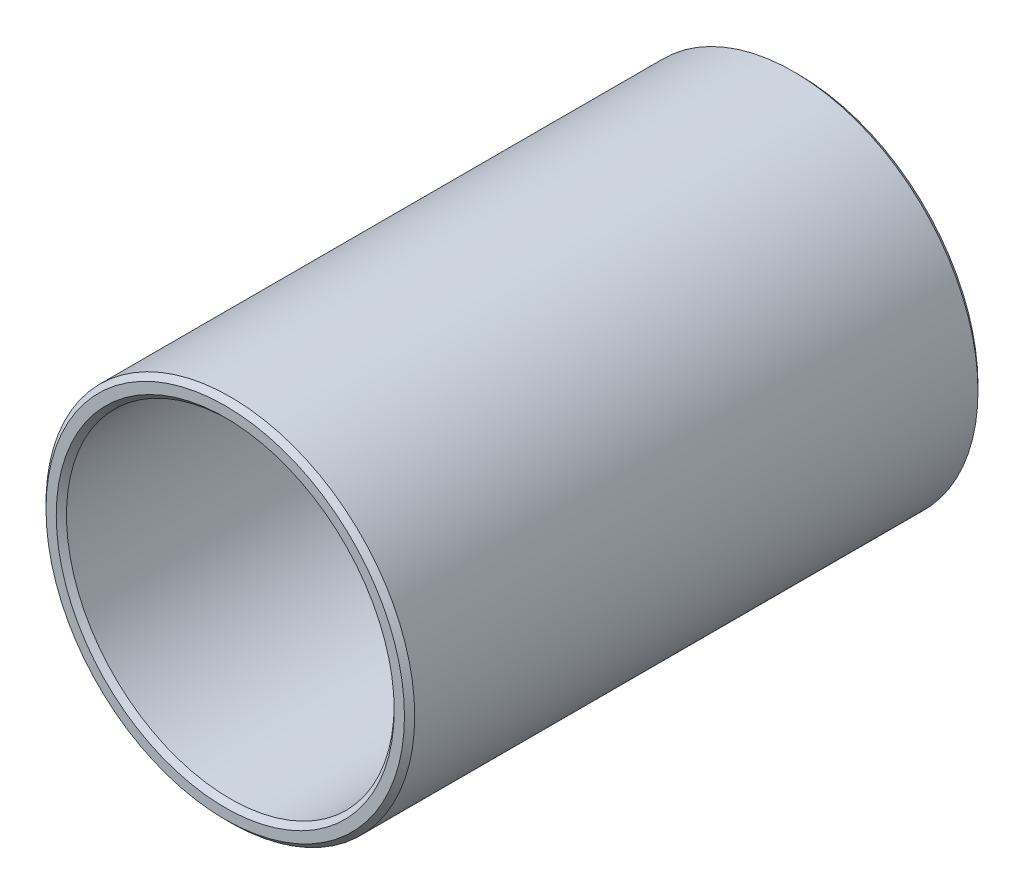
SolidWorks part; units mm, degrees
ref_plane "前视" through (0, 0, 0) normal (0, 0, 1) x (1, 0, 0)
ref_plane "上视" through (0, 0, 0) normal (0, 1, 0) x (1, 0, 0)
ref_plane "右视" through (0, 0, 0) normal (1, 0, 0) x (0, 0, -1)
sketch "草图1" plane through (0, 0, 0) normal (0, 0, 1) x (1, 0, 0)
  circle A0 centre (0, 0) radius 16
  circle A1 centre (0, 0) radius 18
  dimension "D1" = 36
  dimension "D2" = 32
extrude "拉伸1" add sketch "草图1" along normal blind 56
chamfer "倒角1" distance 0.5 angle 45
chamfer "倒角2" distance 0.5 angle 45
